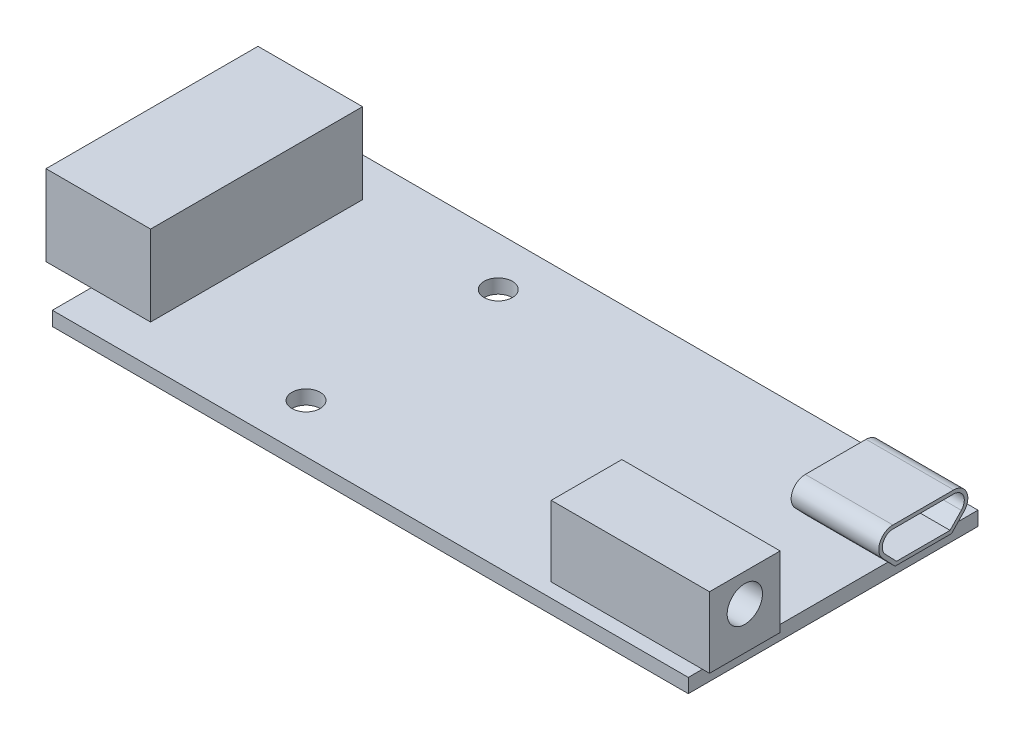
SolidWorks part; units mm, degrees
ref_plane "Front Plane" through (0, 0, 0) normal (0, 0, 1) x (1, 0, 0)
ref_plane "Top Plane" through (0, 0, 0) normal (0, 1, 0) x (1, 0, 0)
ref_plane "Right Plane" through (0, 0, 0) normal (1, 0, 0) x (0, 0, -1)
sketch "Sketch1" plane through (0, 0, 0) normal (0, 1, 0) x (1, 0, 0)
  line L0 (-8, 6.8) -> (-8, -6.8) construction
  line L1 (22.5, -10.25) -> (-22.5, -10.25)
  line L2 (22.5, -10.25) -> (22.5, 10.25)
  line L3 (22.5, 10.25) -> (-22.5, 10.25)
  line L4 (-22.5, -10.25) -> (-22.5, 10.25)
  line L5 (22.5, -10.25) -> (-22.5, 10.25) construction
  line L6 (22.5, 10.25) -> (-22.5, -10.25) construction
  circle A0 centre (-8, 6.8) radius 1
  circle A1 centre (-8, -6.8) radius 1
  point P0 (0, 0)
  point P8 (-8, 0)
  dimension "D5" = 2
  dimension "D1" = 20.5
  dimension "D2" = 45
  dimension "D3" = 14.5
  dimension "D4" = 13.6
extrude "Boss-Extrude1" add sketch "Sketch1" along normal blind 1
sketch "Sketch2" plane through (0, 1, 0) normal (0, 1, 0) x (1, 0, 0)
  line L0 (-22.5, 10.25) -> (-22.5, -10.25) construction
  line L1 (-25.7, 7.5) -> (-18.3, 7.5)
  line L2 (-25.7, 7.5) -> (-25.7, -7.5)
  line L3 (-25.7, -7.5) -> (-18.3, -7.5)
  line L4 (-18.3, 7.5) -> (-18.3, -7.5)
  point P4 (-18.3, 0)
  dimension "D1" = 15
  dimension "D2" = 7.4
  dimension "D3" = 3.2
extrude "Boss-Extrude2" add sketch "Sketch2" along normal blind 5.7
sketch "Sketch3" plane through (-25.7, 0, 0) normal (-1, 0, 0) x (0, 0, 1)
  line L4 (-7.5, 6.7) -> (-7.5, 1) construction
  line L5 (-6.8, 6) -> (6.8, 6)
  line L6 (-6.8, 6) -> (-6.8, 1.7)
  line L7 (-6.8, 1.7) -> (6.8, 1.7)
  line L8 (6.8, 6) -> (6.8, 1.7)
  line L9 (-7.5, 6.7) -> (7.5, 6.7) construction
  point P0 (0, 1.7)
  point P7 (-7.5, 3.85)
  point P9 (-6.8, 3.85)
  dimension "D1" = 0.7
  dimension "D2" = 0.7
extrude "Cut-Extrude1" cut sketch "Sketch3" against normal blind 6
sketch "Sketch4" plane through (0, 1, 0) normal (0, 1, 0) x (1, 0, 0)
  line L0 (-22.5, -10.25) -> (22.5, -10.25) construction
  line L1 (11.8, -4.25) -> (23, -4.25)
  line L2 (11.8, -4.25) -> (11.8, -9.25)
  line L3 (11.8, -9.25) -> (23, -9.25)
  line L4 (23, -4.25) -> (23, -9.25)
  line L5 (22.5, -10.25) -> (22.5, 10.25) construction
  dimension "D1" = 5
  dimension "D2" = 11.2
  dimension "D3" = 1
  dimension "D4" = 0.5
extrude "Boss-Extrude3" add sketch "Sketch4" along normal blind 5
sketch "Sketch5" plane through (23, 0, 0) normal (1, 0, 0) x (0, 0, -1)
  line L0 (-9.25, 6) -> (-4.25, 6) construction
  circle A0 centre (-6.75, 4) radius 1.25
  point P4 (-6.75, 6)
  dimension "D1" = 2
  dimension "D2" = 2.5
extrude "Cut-Extrude2" cut sketch "Sketch5" against normal blind 8
sketch "Sketch6" plane through (22.5, 0, 0) normal (1, 0, 0) x (0, 0, -1)
  line L0 (3.8792, 1) -> (7.8792, 1)
  line L1 (-4.25, 1) -> (10.25, 1) construction
  line L2 (7.8792, 1) -> (8.7512, 1.9069)
  line L3 (8.0303, 3.6) -> (3.728, 3.6)
  line L4 (3.0072, 1.9069) -> (3.8792, 1)
  line L5 (-7.5, 1) -> (7.5, 1) construction
  line L6 (3.9856, 1.25) -> (7.7727, 1.25)
  line L7 (7.7727, 1.25) -> (8.571, 2.0802)
  line L8 (8.0303, 3.35) -> (3.728, 3.35)
  line L9 (3.1874, 2.0802) -> (3.9856, 1.25)
  arc A0 (8.7512, 1.9069) -> (8.0303, 3.6) centre (8.0303, 2.6) ccw
  arc A1 (3.728, 3.6) -> (3.0072, 1.9069) centre (3.728, 2.6) ccw
  arc A2 (8.571, 2.0802) -> (8.0303, 3.35) centre (8.0303, 2.6) ccw
  arc A3 (3.728, 3.35) -> (3.1874, 2.0802) centre (3.728, 2.6) ccw
  point P4 (8.9857, 1)
  point P7 (5.8792, 3.6)
  point P8 (5.8792, 1)
  point P9 (-0.4839, 1)
  point P10 (-0.8269, 1.5572)
  point P11 (0.4228, 1)
  point P14 (10.3792, 3.6)
  point P17 (1.3792, 3.6)
  point P18 (8.0489, 1)
  point P19 (2.2374, 1)
  point P30 (7.6768, 1)
  point P31 (7.8792, 1)
  dimension "D3" = 1
  dimension "D1" = 9
  dimension "D2" = 2.6
  dimension "D4" = 4
  dimension "D5" = 0.25
extrude "Boss-Extrude4" add sketch "Sketch6" against normal blind 5.7 and the other way blind 0.5
